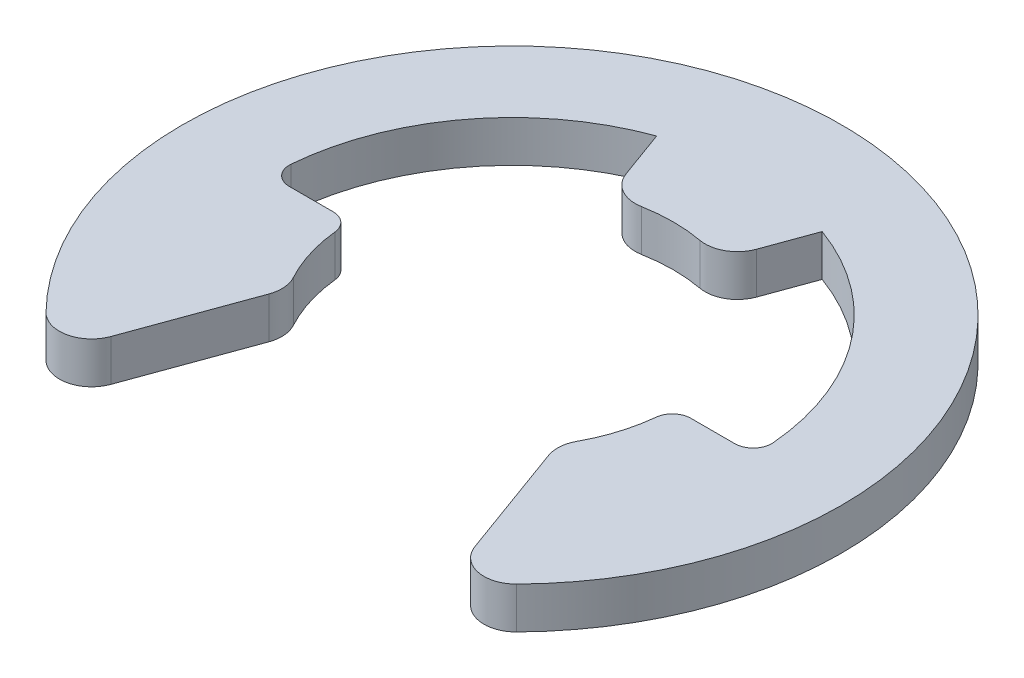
SolidWorks part; units mm, degrees
ref_plane "Front Plane" through (0, 0, 0) normal (0, 0, 1) x (1, 0, 0)
ref_plane "Top Plane" through (0, 0, 0) normal (0, 1, 0) x (1, 0, 0)
ref_plane "Right Plane" through (0, 0, 0) normal (1, 0, 0) x (0, 0, -1)
sketch "Sketch2" plane through (0, 0, 0) normal (0, 1, 0) x (1, 0, 0)
  line L0 (-4.2975, -5.7144) -> (-2.92, -1.9297)
  line L2 (2.92, -1.9297) -> (4.2975, -5.7144)
  line L4 (-3.5, 0) -> (-5.25, 0)
  line L5 (3.5, 0) -> (5.25, 0)
  line L6 (-1.7956, 4.9334) -> (-1.1971, 3.2889)
  line L8 (1.1971, 3.2889) -> (1.7956, 4.9334)
  arc A0 (4.2975, -5.7144) -> (-4.2975, -5.7144) centre (0, 0) ccw
  arc A1 (2.92, -1.9297) -> (3.5, 0) centre (0, 0) ccw
  arc A2 (5.25, 0) -> (1.7956, 4.9334) centre (0, 0) ccw
  arc A3 (-3.5, 0) -> (-2.92, -1.9297) centre (0, 0) ccw
  arc A4 (1.1971, 3.2889) -> (-1.1971, 3.2889) centre (0, 0) ccw
  arc A5 (-1.7956, 4.9334) -> (-5.25, 0) centre (0, 0) ccw
  point P15 (0, 0)
  point P16 (0, 3.5)
  dimension "D1" = 14.3
  dimension "D2" = 7
  dimension "D3" = 10.5
  dimension "D4" = 70
  dimension "D5" = 70
  dimension "D6" = 5.84
  dimension "D7" = 40
extrude "Boss-Extrude1" add sketch "Sketch2" along normal mid plane 0.9
fillet "Fillet1" radius 0.7 6 edges at (2.92, 0, 1.9297) (-2.92, 0, 1.9297) (1.1971, 0, -3.2889) (-1.1971, 0, -3.2889) (4.2975, 0, 5.7144) (-4.2975, 0, 5.7144)
fillet "Fillet2" radius 0.4 4 edges at (5.25, 0, 0) (3.5, 0, 0) (-5.25, 0, 0) (-3.5, 0, 0)
